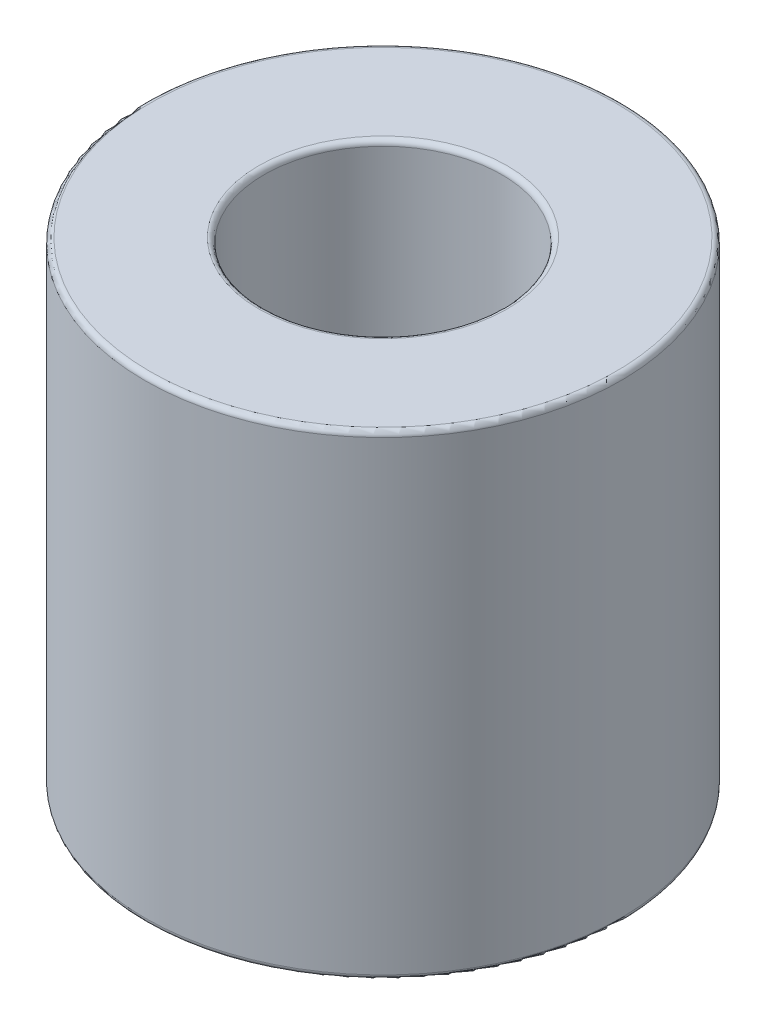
SolidWorks part; units mm, degrees
ref_plane "Front Plane" through (0, 0, 0) normal (0, 0, 1) x (1, 0, 0)
ref_plane "Top Plane" through (0, 0, 0) normal (0, 1, 0) x (1, 0, 0)
ref_plane "Right Plane" through (0, 0, 0) normal (1, 0, 0) x (0, 0, -1)
sketch "Sketch1" plane through (0, 0, 0) normal (0, 1, 0) x (1, 0, 0)
  circle A0 centre (0, 0) radius 3.175
  circle A1 centre (0, 0) radius 1.5875
  point P4 (0, -3.175)
  point P5 (0, -1.5875)
  point P6 (0, 1.5875)
  point P7 (0, 3.175)
  point P8 (-3.175, 0)
  point P9 (3.175, 0)
sketch "Sketch2" plane through (0, 0, 0) normal (0, 0, 1) x (1, 0, 0)
  line L0 (0, 3.175) -> (0, -3.175) construction
  point P0 (0, 3.175)
  point P3 (0, -3.175)
  point P4 (0, 0)
  point P9 (-3.175, 3.175)
  point P10 (-3.175, -3.175)
  dimension "Thickness" = 6.35
sketch "Sketch3" plane through (0, 0, 0) normal (0, 1, 0) x (1, 0, 0)
  circle A0 centre (0, 0) radius 1.5875 construction
  circle A1 centre (0, 0) radius 3.175 construction
  circle A2 centre (0, 0) radius 1.5875
  circle A3 centre (0, 0) radius 3.175
extrude "Boss-Extrude1" add sketch "Sketch3" against normal up to vertex (3.175 mm away) and the other way up to vertex (3.175 mm away)
fillet "Fillet2" radius 0.0698 4 edges at (0, 3.175, 3.175) (0, -3.175, 3.175) (0, -3.175, 1.5875) (0, 3.175, 1.5875)
equation "\"D1@Fillet2\"=\"OD@Sketch1\"*.011"
